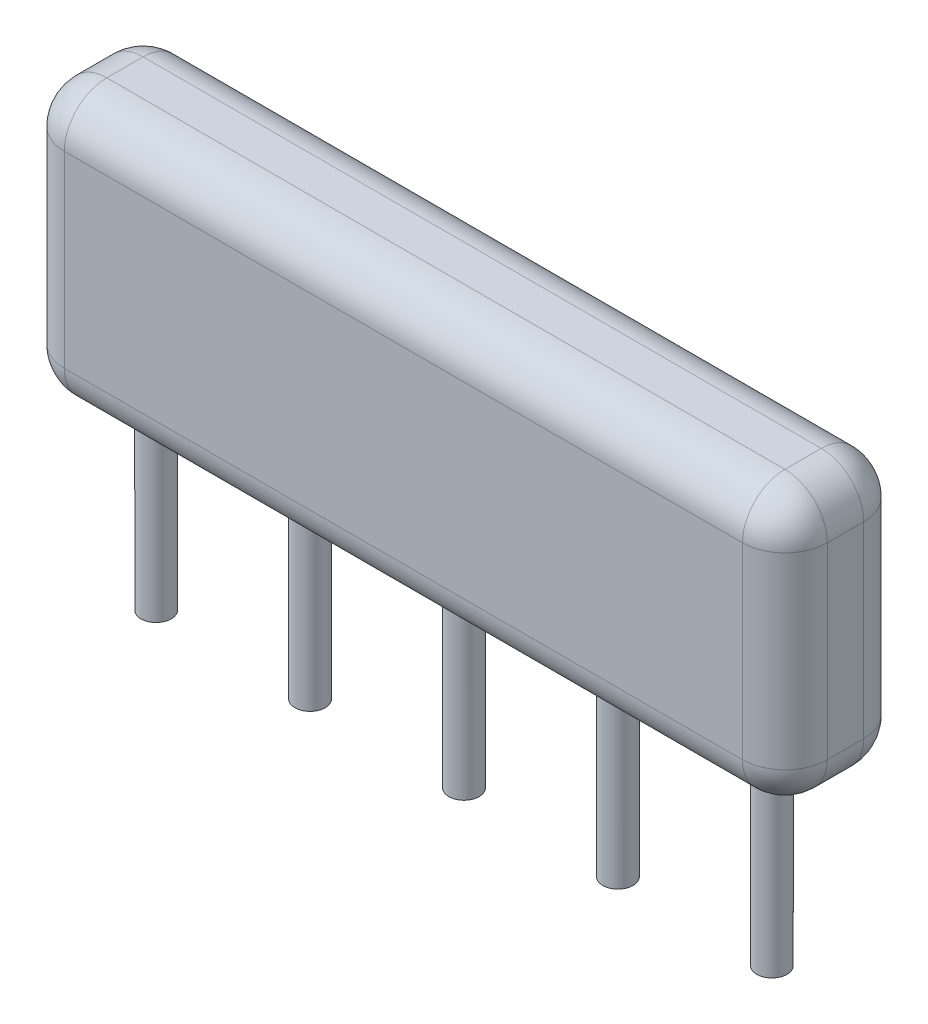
SolidWorks part; units mm, degrees
ref_plane "Plan de face" through (0, 0, 0) normal (0, 0, 1) x (1, 0, 0)
ref_plane "Plan de dessus" through (0, 0, 0) normal (0, 1, 0) x (1, 0, 0)
ref_plane "Plan de droite" through (0, 0, 0) normal (1, 0, 0) x (0, 0, -1)
sketch "Esquisse1" plane through (0, 0, 0) normal (0, 0, 1) x (1, 0, 0)
  line L0 (-5.0078, 0) -> (28.2436, 0) construction
  line L1 (0, 20.7361) -> (0, -4.1678) construction
  line L2 (22.75, 21.4002) -> (22.75, -4.1678) construction
  line L3 (-5.0078, 4.5) -> (25.5882, 4.5) construction
  line L4 (-5.0078, -4.15) -> (28.2436, -4.15) construction
  line L6 (0, 4.5) -> (12.59, 4.5)
  line L7 (0, 4.5) -> (0, 0)
  line L8 (0, 0) -> (12.59, 0)
  line L9 (12.59, 4.5) -> (12.59, 0)
  dimension "D1" = 8.65
extrude "Extrusion1" add sketch "Esquisse1" along normal blind 2
sketch "Esquisse2" plane through (0, 0, 0) normal (0, -1, 0) x (1, 0, 0)
  line L0 (-0.9998, 1) -> (24.1218, 1) construction
  line L1 (1.215, 3.8409) -> (1.215, -3.3204) construction
  line L2 (0, 2) -> (12.59, 2) construction
  circle A0 centre (1.215, 1) radius 0.25
  circle A1 centre (3.755, 1) radius 0.25
  circle A2 centre (6.295, 1) radius 0.25
  circle A3 centre (8.835, 1) radius 0.25
  circle A4 centre (11.375, 1) radius 0.25
extrude "Extrusion2" add sketch "Esquisse2" along normal blind 3
fillet "Congé1" radius 0.7 12 edges at (0, 2.25, 0) (0, 0, 1) (12.59, 0, 1) (0, 4.5, 1) (12.59, 4.5, 1) (6.295, 0, 0) (6.295, 0, 2) (6.295, 4.5, 0) (6.295, 4.5, 2) (12.59, 2.25, 0) (12.59, 2.25, 2) (0, 2.25, 2)
